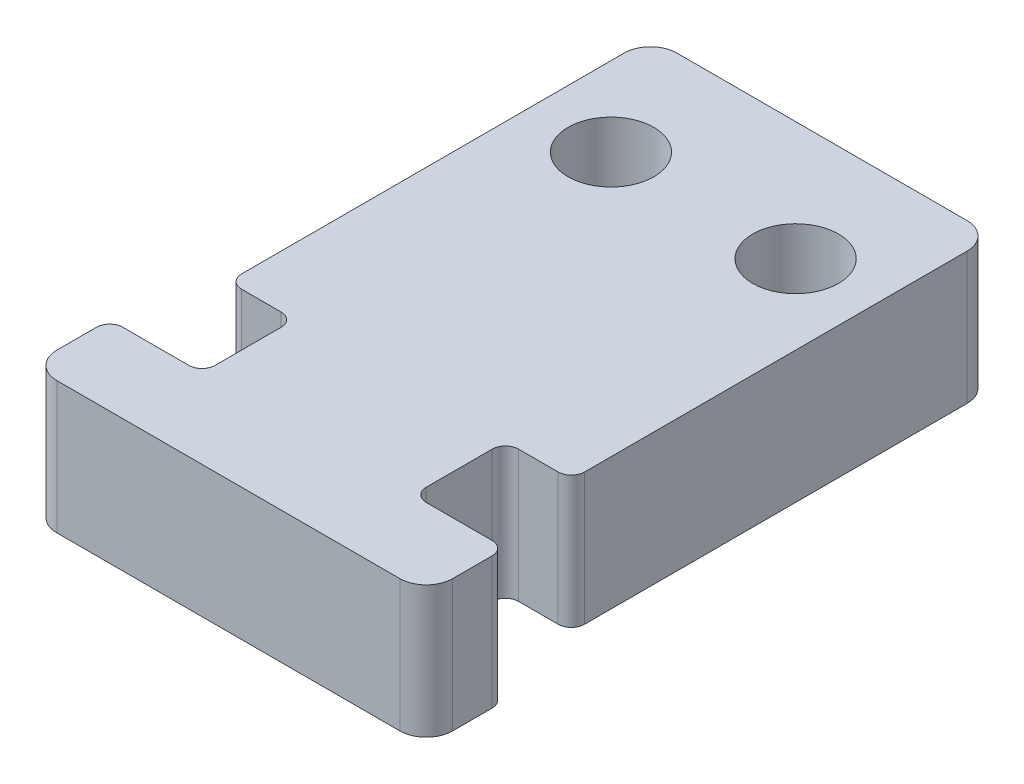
SolidWorks part; units mm, degrees
ref_plane "Front" through (0, 0, 0) normal (0, 0, 1) x (1, 0, 0)
ref_plane "Top" through (0, 0, 0) normal (0, 1, 0) x (1, 0, 0)
ref_plane "Right" through (0, 0, 0) normal (1, 0, 0) x (0, 0, -1)
sketch "Sketch1" plane through (0, 0, 0) normal (0, 1, 0) x (1, 0, 0)
  line L0 (0, 0) -> (0, 45) construction
  line L1 (13, 45) -> (-13, 45)
  line L2 (13, 45) -> (13, 13)
  line L3 (15, 0) -> (-15, 0)
  line L4 (-13, 45) -> (-13, 13)
  line L7 (13, 13) -> (8, 13)
  line L9 (15, 6) -> (8, 6)
  line L10 (8, 13) -> (8, 6)
  line L11 (-8, 13) -> (-8, 6)
  line L12 (-15, 6) -> (-8, 6)
  line L14 (-13, 13) -> (-8, 13)
  line L15 (-15, 6) -> (-15, 0)
  line L16 (15, 6) -> (15, 0)
  point P0 (0, 0)
extrude "Boss-Extrude1" add sketch "Sketch1" along normal blind 10
fillet "Fillet1" radius 2 4 edges at (-13, 5, -45) (13, 5, -45) (15, 5, 0) (-15, 5, 0)
sketch "Sketch2" plane through (0, 10, 0) normal (0, 1, 0) x (1, 0, 0)
  line L0 (11, 45) -> (-11, 45) construction
  line L1 (13, 13) -> (13, 43) construction
  circle A0 centre (7, 36) radius 3.25
fillet "Fillet2" radius 1 8 edges at (-8, 5, -6) (-8, 5, -13) (-13, 5, -13) (13, 5, -13) (8, 5, -13) (8, 5, -6) (15, 5, -6) (-15, 5, -6)
extrude "Cut-Extrude1" cut sketch "Sketch2" against normal through all
mirror "Mirror1" about plane through (0, 0, 0) normal (1, 0, 0) of "Cut-Extrude1"
equation "\"Var1\"= 0.2"
equation "\"D2@Sketch2\"= \"Längd@Sketch1\" * \"Var1\""
